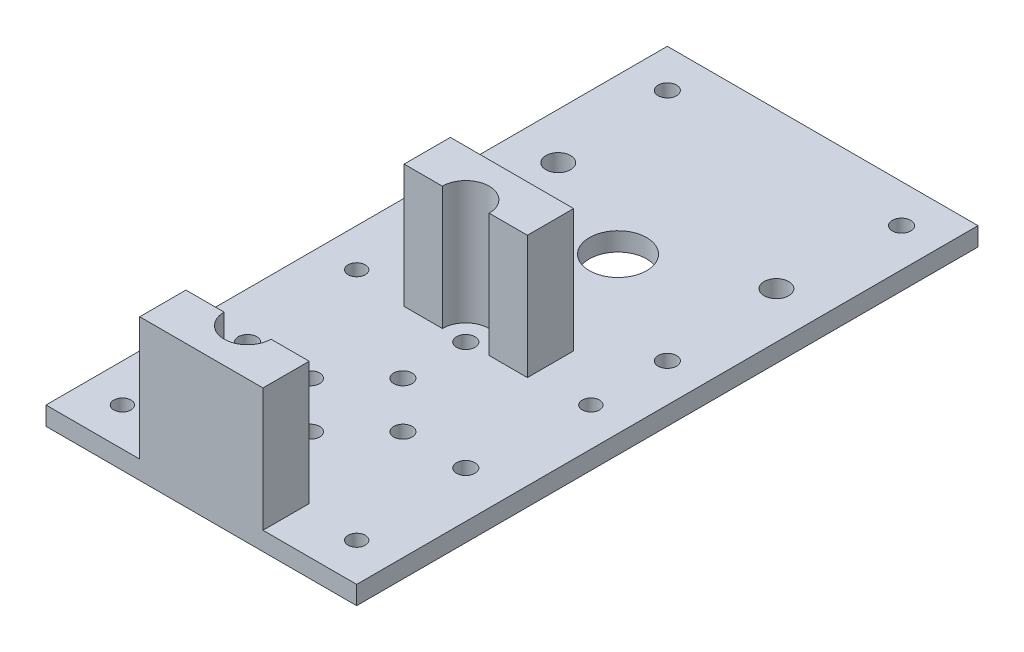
SolidWorks part; units mm, degrees
other "<电机盖板>-<切除-拉伸2>"
ref_plane "前视基准面" through (0, 0, 0) normal (0, 0, 1) x (1, 0, 0)
ref_plane "上视基准面" through (0, 0, 0) normal (0, 1, 0) x (1, 0, 0)
ref_plane "右视基准面" through (0, 0, 0) normal (1, 0, 0) x (0, 0, -1)
sketch "草图2" plane through (0, 0, 0) normal (0, 1, 0) x (1, 0, 0)
  line L0 (0, 82.3651) -> (0, -61.7315) construction
  line L1 (-25.2, 25.2) -> (25.2, 25.2)
  line L2 (-25.2, 25.2) -> (-25.2, -25.2)
  line L3 (-25.2, -25.2) -> (25.2, -25.2)
  line L4 (25.2, 25.2) -> (25.2, -25.2)
  line L5 (-25.2, 25.2) -> (25.2, -25.2) construction
  line L6 (-25.2, -25.2) -> (25.2, 25.2) construction
  line L7 (-92.1745, 0) -> (112.4698, 0) construction
  point P0 (0, 0)
  dimension "D1" = 50.4
  dimension "D2" = 50.4
extrude "凸台-拉伸1" add sketch "草图2" against normal blind 3
sketch "草图3" plane through (0, 0, 0) normal (0, 1, 0) x (1, 0, 0)
  line L0 (-31.4477, 0) -> (38.2819, 0) construction
  line L1 (0, 26.7492) -> (0, -28.5646) construction
  circle A0 centre (0, 17.7) radius 1.5
  circle A2 centre (17.7, 0) radius 1.5
  circle A3 centre (0, -17.7) radius 1.5
  circle A4 centre (-17.7, 0) radius 1.5
  point P16 (0, 0)
  dimension "D1" = 3
  dimension "D2" = 17.7
  dimension "D3" = 4
extrude "切除-拉伸1" cut sketch "草图3" against normal through all and the other way through all
sketch "草图4" plane through (0, 0, 0) normal (0, 1, 0) x (1, 0, 0)
  line L0 (-46.7177, 0) -> (39.2429, 0) construction
  line L1 (0, 26.6425) -> (0, -30.0595) construction
  circle A0 centre (-19, 19) radius 1.4
  circle A1 centre (19, 19) radius 1.4
  circle A2 centre (19, -19) radius 1.4
  circle A3 centre (-19, -19) radius 1.4
  point P16 (0, 0)
  dimension "D1" = 2.8
  dimension "D2" = 19
  dimension "D3" = 19
  dimension "D4" = 4
extrude "切除-拉伸2" cut sketch "草图4" against normal through all
sketch "草图6" plane through (0, 0, 0) normal (0, 1, 0) x (1, 0, 0)
  line L0 (0, 54.1326) -> (0, -44.8791) construction
  line L1 (-61.4686, 0) -> (76.0475, 0) construction
  line L2 (25.2, 25.2) -> (-25.2, 25.2) construction
  line L3 (10, 17.7) -> (3.8, 17.7)
  line L4 (10, 17.7) -> (10, 25.2)
  line L5 (10, 25.2) -> (-10, 25.2)
  line L6 (-10, 17.7) -> (-10, 25.2)
  line L7 (10, 17.7) -> (-10, 25.2) construction
  line L8 (10, 25.2) -> (-10, 17.7) construction
  line L9 (-3.8, 17.7) -> (-10, 17.7)
  line L10 (10, -17.7) -> (3.8, -17.7)
  line L11 (10, -17.7) -> (10, -25.2)
  line L12 (10, -25.2) -> (-10, -25.2)
  line L13 (-10, -17.7) -> (-10, -25.2)
  line L14 (-3.8, -17.7) -> (-10, -17.7)
  circle A0 centre (-19, 19) radius 1.4 construction
  circle A1 centre (-19, 19) radius 1.4 construction
  circle A2 centre (-19, 19) radius 6 construction
  circle A3 centre (0, 17.7) radius 1.5 construction
  circle A4 centre (0, 17.7) radius 1.5 construction
  arc A5 (3.8, 17.7) -> (-3.8, 17.7) centre (0, 17.7) ccw
  arc A6 (3.8, -17.7) -> (-3.8, -17.7) centre (0, -17.7) cw
  point P13 (0, 21.45)
  dimension "D1" = 12
  dimension "D2" = 7.6
  dimension "D3" = 20
  dimension "D4" = 7.5
extrude "凸台-拉伸2" add sketch "草图6" along normal blind 20
sketch "草图7" plane through (0, 0, 0) normal (0, 1, 0) x (1, 0, 0)
  line L0 (0, 41.0775) -> (0, -39.4084) construction
  line L1 (-47.5683, 0) -> (52.39, 0) construction
  circle A0 centre (0, 7.5) radius 1.5
  circle A2 centre (7.5, 0) radius 1.5
  circle A3 centre (0, -7.5) radius 1.5
  circle A4 centre (-7.5, 0) radius 1.5
  point P16 (0, 0)
  dimension "D1" = 3
  dimension "D2" = 7.5
  dimension "D3" = 4
extrude "切除-拉伸3" cut sketch "草图7" against normal blind 10
inserted part "电机盖板"
move or copy body "实体-移动/复制2" placed by mates yes
combine bodies "组合1" operation type add bodies to combine 112 110
